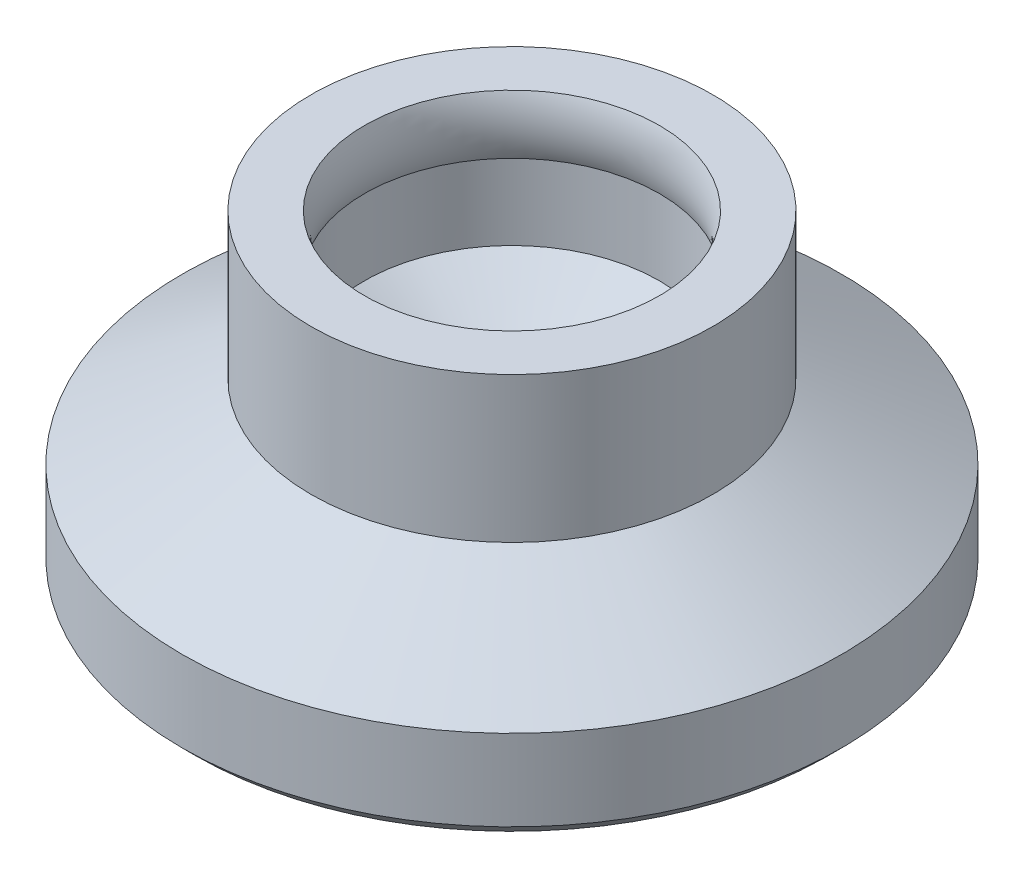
SolidWorks part; units mm, degrees
ref_plane "Front Plane" through (0, 0, 0) normal (0, 0, 1) x (1, 0, 0)
ref_plane "Top Plane" through (0, 0, 0) normal (0, 1, 0) x (1, 0, 0)
ref_plane "Right Plane" through (0, 0, 0) normal (1, 0, 0) x (0, 0, -1)
sketch "Sketch1" plane through (0, 0, 0) normal (0, 1, 0) x (1, 0, 0)
  circle A0 centre (0, 0) radius 6.4
  dimension "D1" = 12.8
extrude "Extrude1" add sketch "Sketch1" along normal mid plane 10
sketch "Sketch3" plane through (0, -5, 0) normal (0, -1, 0) x (1, 0, 0)
  circle A0 centre (0, 0) radius 10.5
  dimension "D1" = 21
extrude "Extrude2" add sketch "Sketch3" against normal blind 3
sketch "Sketch4" plane through (0, 0, 0) normal (0, 0, 1) x (1, 0, 0)
  line L0 (-10.5, -2) -> (-6.4, 0.3671)
  line L1 (-6.4, 5) -> (-6.4, -2) construction
  line L2 (-6.4, 0.3671) -> (-6.4, -2)
  line L3 (-6.4, -2) -> (-10.5, -2)
  dimension "D1" = 30
revolve "Revolve1" add sketch "Sketch4" angle 360 about axis through (0, 5, 0) along (0, -1, 0)
chamfer "Chamfer1" distance 0.42 angle 45 1 edges at (0, -5, -10.5)
sketch "Sketch5" plane through (0, 0, 0) normal (0, 0, 1) x (1, 0, 0)
  line L1 (0, 0) -> (0, 11.3083) construction
  line L2 (0, 5) -> (4.7, 5)
  line L3 (6.4, 5) -> (-6.4, 5) construction
  line L4 (4.7, 3.12) -> (4.7, 0.7135)
  line L5 (4.7, 0.7135) -> (0, -2)
  line L6 (0, -2) -> (0, 5)
  line L7 (10.5, -2) -> (-10.5, -2) construction
  arc A0 (4.7, 5) -> (4.7, 3.12) centre (6.956, 4.06) ccw
  point P14 (4.512, 4.06)
  dimension "D2" = 9.4
  dimension "D1" = 60
  dimension "D3" = 1.88
  dimension "D4" = 0.188
revolve "Cut-Revolve1" cut sketch "Sketch5" angle 360 about L1
equation "\"D3@Sketch5\" = \"D2@Sketch5\"*0.2"
equation "\"D4@Sketch5\" = \"D3@Sketch5\"*0.1"
